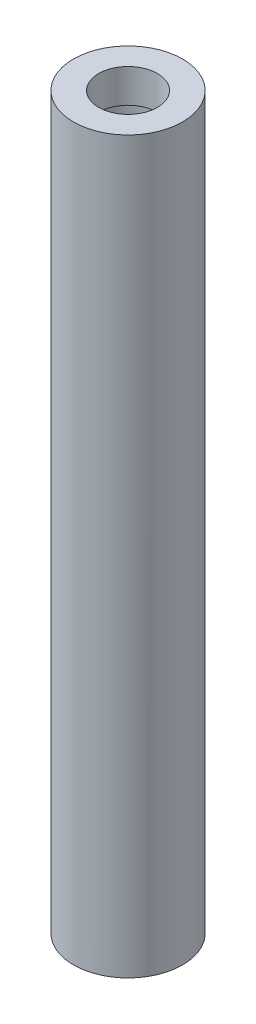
SolidWorks part; units mm, degrees
ref_plane "Front Plane" through (0, 0, 0) normal (0, 0, 1) x (1, 0, 0)
ref_plane "Top Plane" through (0, 0, 0) normal (0, 1, 0) x (1, 0, 0)
ref_plane "Right Plane" through (0, 0, 0) normal (1, 0, 0) x (0, 0, -1)
sketch "Sketch1" plane through (0, 0, 0) normal (0, 1, 0) x (1, 0, 0)
  circle A0 centre (0, 0) radius 3.25
  dimension "D1" = 6.5
extrude "Boss-Extrude1" add sketch "Sketch1" along normal blind 39.5
sketch "Sketch3" plane through (0, 39.5, 0) normal (0, 1, 0) x (1, 0, 0)
  circle A0 centre (0, 0) radius 2.25
  dimension "D1" = 4.5
extrude "Cut-Extrude1" cut sketch "Sketch3" against normal blind 53
sketch "Sketch4" plane through (0, 0, 0) normal (0, -1, 0) x (1, 0, 0)
  circle A0 centre (0, 0) radius 3.25
  circle A1 centre (0, 0) radius 1.75
  dimension "D1" = 3.5
extrude "Boss-Extrude2" add sketch "Sketch4" along normal blind 2
sketch "Sketch5" plane through (0, 39.5, 0) normal (0, 1, 0) x (1, 0, 0)
  circle A0 centre (0, 0) radius 1.75
  circle A1 centre (0, 0) radius 3.25
  dimension "D1" = 3.5
extrude "Boss-Extrude3" add sketch "Sketch5" along normal blind 2
